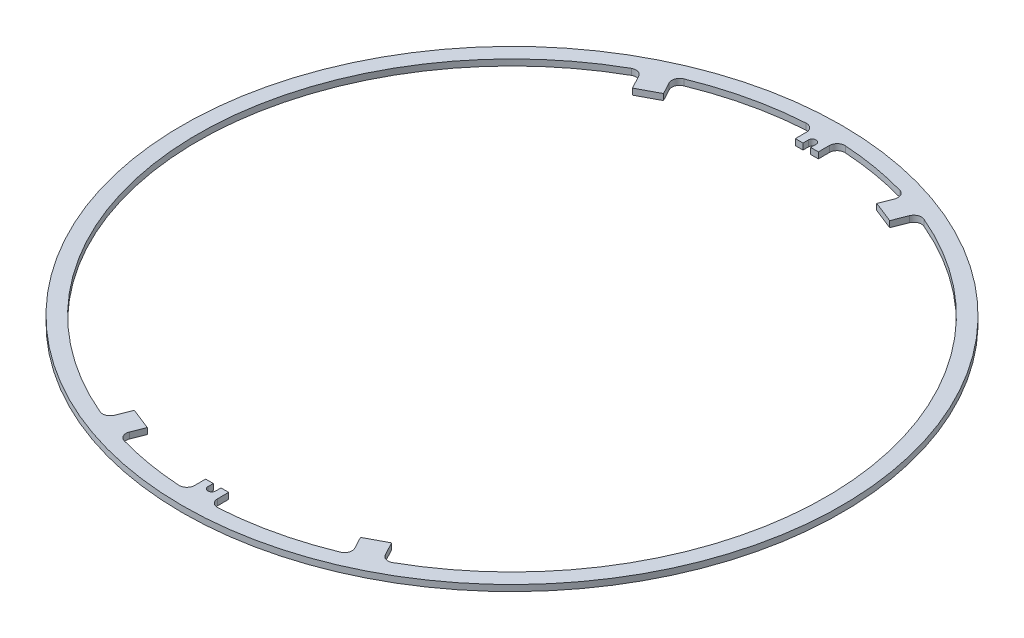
SolidWorks part; units mm, degrees
ref_plane "前视基准面" through (0, 0, 0) normal (0, 0, 1) x (1, 0, 0)
ref_plane "上视基准面" through (0, 0, 0) normal (0, 1, 0) x (1, 0, 0)
ref_plane "右视基准面" through (0, 0, 0) normal (1, 0, 0) x (0, 0, -1)
sketch "草图1" plane through (0, 0, 0) normal (0, 1, 0) x (1, 0, 0)
  circle A0 centre (0, 0) radius 43
  circle A1 centre (0, 0) radius 41
  circle A2 centre (0, 0) radius 35 construction
  dimension "D1" = 86
  dimension "D2" = 2
  dimension "D3" = 70
extrude "凸台-拉伸1" add sketch "草图1" along normal blind 0.8
sketch "草图2" plane through (0, 0.8, 0) normal (0, 1, 0) x (1, 0, 0)
  line L0 (0, 0) -> (0, 47.3857) construction
  line L1 (-1.5, 40.9726) -> (-1.5, 38.4726)
  line L2 (-1.5, 38.4726) -> (1.5, 38.4726)
  line L3 (1.5, 40.9726) -> (1.5, 38.4726)
  line L4 (0, 0) -> (51.4644, 0) construction
  line L5 (1.5, -40.9726) -> (1.5, -38.4726)
  line L6 (-1.5, -40.9726) -> (-1.5, -38.4726)
  line L7 (-1.5, -38.4726) -> (1.5, -38.4726)
  circle A0 centre (0, 0) radius 41 construction
  circle A1 centre (0, 0) radius 41
  point P10 (0, 38.4726)
  dimension "D1" = 2.5
  dimension "D2" = 3
extrude "凸台-拉伸2" add sketch "草图2" against normal up to surface (0.8 mm away) contours L7 L6 L5 M8 | L3 L1 L2 M8
fillet "圆角1" radius 1 2 edges at (1.5, 0.4, -40.9726) (-1.5, 0.4, -40.9726)
fillet "圆角2" radius 1 2 edges at (1.5, 0.4, 40.9726) (-1.5, 0.4, 40.9726)
sketch "草图3" plane through (0, 0, 0) normal (0, -1, 0) x (1, 0, 0)
  line L0 (0, 39.1726) -> (0, 38.4726) construction
  line L1 (1.5, 38.4726) -> (-1.5, 38.4726) construction
  line L2 (-0.5, 39.1726) -> (-0.5, 36.1726)
  line L3 (-0.5, 36.1726) -> (0.5, 36.1726)
  line L4 (0.5, 36.1726) -> (0.5, 39.1726)
  line L5 (0, 0) -> (11.294, 0) construction
  line L6 (0, -39.1726) -> (0, -38.4726) construction
  line L7 (0.5, -36.1726) -> (0.5, -39.1726)
  line L8 (-0.5, -36.1726) -> (0.5, -36.1726)
  line L9 (-0.5, -39.1726) -> (-0.5, -36.1726)
  arc A0 (0.5, 39.1726) -> (-0.5, 39.1726) centre (0, 39.1726) ccw
  arc A1 (0.5, -39.1726) -> (-0.5, -39.1726) centre (0, -39.1726) cw
  dimension "D1" = 1
  dimension "D2" = 3
  dimension "D3" = 0.7
extrude "切除-拉伸1" cut sketch "草图3" against normal through all
sketch "草图4" plane through (0, 0.8, 0) normal (0, 1, 0) x (1, 0, 0)
  line L0 (0, 0) -> (-15.0266, -38.1471) construction
  line L1 (0, 0) -> (0, -48.4381) construction
  line L2 (-15.0266, -38.1471) -> (-13.927, -35.3559)
  line L3 (-13.927, -35.3559) -> (-11.1358, -36.4554)
  line L4 (-11.1358, -36.4554) -> (-12.195, -39.1444)
  line L5 (15.0266, 38.1471) -> (13.927, 35.3559)
  line L6 (13.927, 35.3559) -> (11.1358, 36.4554)
  line L7 (11.1358, 36.4554) -> (12.195, 39.1444)
  arc A0 (-2.5625, 40.9198) -> (-2.5625, -40.9198) centre (0, 0) ccw construction
  arc A1 (-15.0266, -38.1471) -> (-12.195, -39.1444) centre (0, 0) ccw
  arc A2 (15.0266, 38.1471) -> (12.195, 39.1444) centre (0, 0) ccw
  point P16 (0, 0)
  dimension "D1" = 3
  dimension "D2" = 3
  dimension "D4" = 21.5
  dimension "D3" = 2
extrude "凸台-拉伸3" add sketch "草图4" against normal up to surface (0.8 mm away)
fillet "圆角3" radius 1 4 edges at (15.0266, 0.4, -38.1471) (12.195, 0.4, -39.1444) (-12.195, 0.4, 39.1444) (-15.0266, 0.4, 38.1471)
sketch "草图5" plane through (0, 0, 0) normal (0, -1, 0) x (1, 0, 0)
  line L0 (0, 0) -> (-13.927, 35.3559) construction
  line L1 (0, 0) -> (19.2483, 36.2009) construction
  line L2 (19.2483, 36.2009) -> (17.8399, 33.552)
  line L3 (17.8399, 33.552) -> (15.1911, 34.9604)
  line L4 (15.1911, 34.9604) -> (16.5479, 37.5122)
  line L5 (-17.8399, -33.552) -> (-15.1911, -34.9604)
  line L6 (-15.1911, -34.9604) -> (-16.5479, -37.5122)
  line L7 (-19.2483, -36.2009) -> (-17.8399, -33.552)
  arc A0 (15.9755, -37.7595) -> (2.5625, 40.9198) centre (0, 0) ccw construction
  arc A1 (19.2483, 36.2009) -> (16.5479, 37.5122) centre (0, 0) ccw
  arc A2 (-19.2483, -36.2009) -> (-16.5479, -37.5122) centre (0, 0) ccw
  point P18 (0, 0)
  dimension "D1" = 49.5
  dimension "D2" = 3
  dimension "D3" = 3
  dimension "D4" = 2
extrude "凸台-拉伸5" add sketch "草图5" against normal up to surface (0.8 mm away)
fillet "圆角4" radius 1 4 edges at (-16.5479, 0.4, -37.5122) (-19.2483, 0.4, -36.2009) (16.5479, 0.4, 37.5122) (19.2483, 0.4, 36.2009)
